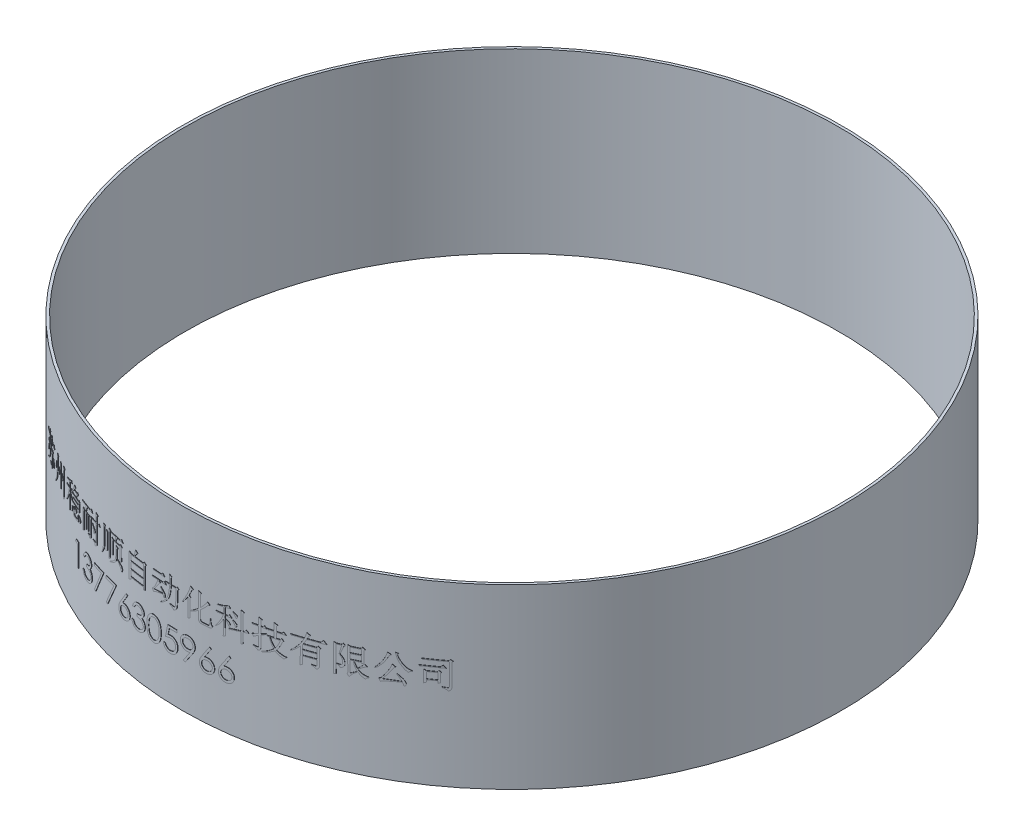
SolidWorks part; units mm, degrees
ref_plane "前视" through (0, 0, 0) normal (0, 0, 1) x (1, 0, 0)
ref_plane "上视" through (0, 0, 0) normal (0, 1, 0) x (1, 0, 0)
ref_plane "右视" through (0, 0, 0) normal (1, 0, 0) x (0, 0, -1)
sketch "草图1" plane through (0, 0, 0) normal (0, 1, 0) x (1, 0, 0)
  circle A0 centre (0, 0) radius 190
  circle A1 centre (0, 0) radius 191.5
  dimension "D1" = 383
  dimension "D2" = 380
extrude "凸台-拉伸1" add sketch "草图1" along normal blind 103
sketch "草图2" plane through (0, 0, 0) normal (0, 0, 1) x (1, 0, 0)
  line L0 (-130, 50) -> (130, 50) construction
  text T0 "苏州稳耐顺自动化科技有限公司           13776305966" font "Century Gothic" height 13.35
  dimension "D1" = 50
  dimension "D2" = 260
  dimension "D3" = 130
wrap "包覆1" sketch "草图2" wrap type emboss source sketch "草图2" thickness 0.2 parameters "D1"=0.2
